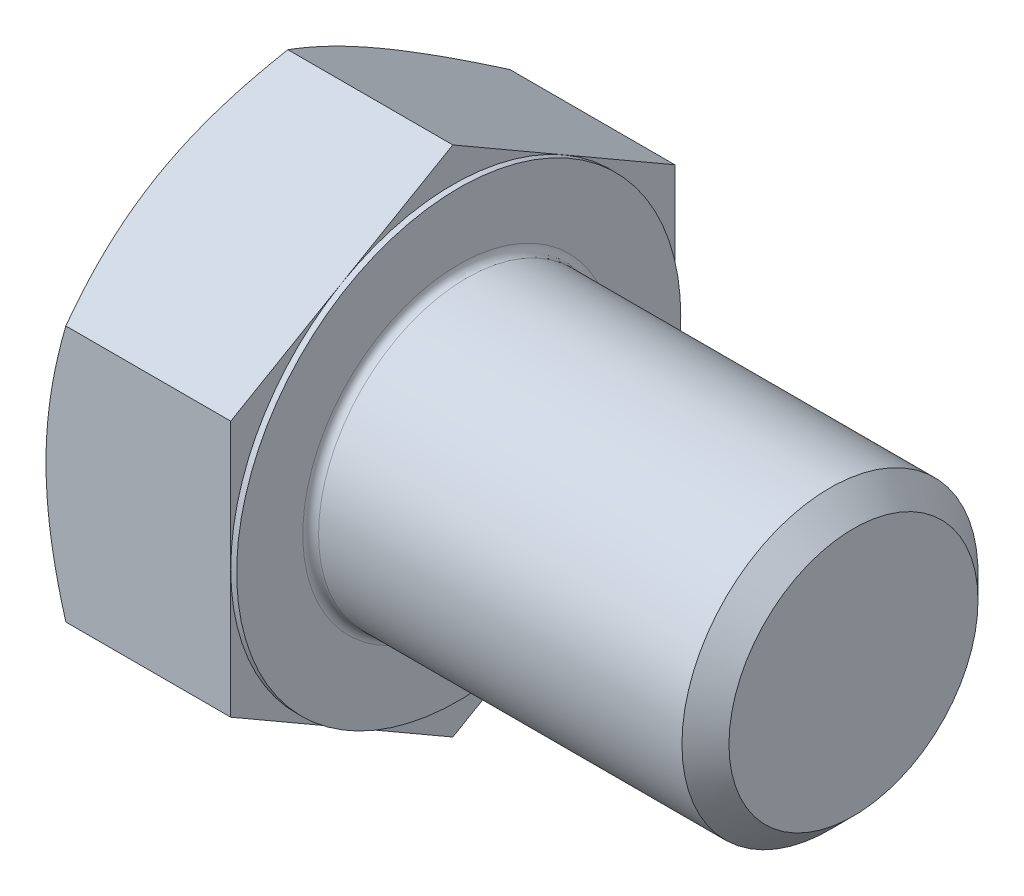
SolidWorks part; units mm, degrees
extrude "BaseHead" add sketch "Sketch1" along normal blind 12.2682
sketch "Sketch1" plane through (0, 0, 0) normal (1, 0, 0) x (0, 0, -1)
  line L0 (14.2875, 8.2489) -> (14.2875, -8.2489)
  line L1 (-14.2875, 8.2489) -> (-14.2875, -8.2489)
  line L2 (14.2875, -8.2489) -> (0, -16.4978)
  line L3 (0, -16.4978) -> (-14.2875, -8.2489)
  line L4 (14.2875, 8.2489) -> (0, 16.4978)
  line L5 (0, 16.4978) -> (-14.2875, 8.2489)
revolve "HeadChamfer" cut sketch "Sketch3" angle 360 about L6
sketch "Sketch3" plane through (0, 0, 0) normal (0, 0, 1) x (1, 0, 0)
  line L0 (0, 14.2875) -> (4.9423, 22.8478)
  line L1 (0, 16.4978) -> (0, 8.2489) construction
  line L2 (4.9423, 22.8478) -> (4.9423, 29.1978)
  line L3 (4.9423, 29.1978) -> (-12.7, 29.1978)
  line L4 (-12.7, 29.1978) -> (-12.7, 14.2875)
  line L5 (-12.7, 14.2875) -> (0, 14.2875)
  line L6 (0, 0) -> (99.06, 0) construction
  line L7 (12.2682, 16.4978) -> (0, 16.4978) construction
ref_plane "Plane1" through (0, 0, 0) normal (0, 0, 1) x (1, 0, 0)
ref_plane "Plane2" through (0, 0, 0) normal (0, 1, 0) x (1, 0, 0)
ref_plane "Plane3" through (0, 0, 0) normal (1, 0, 0) x (0, 0, -1)
sketch "BodySke" plane through (0, 0, 0) normal (0, 0, 1) x (1, 0, 0)
  line L0 (0, 8.2489) -> (0, -8.2489) construction
  line L1 (0, 0) -> (37.6682, 0)
  line L2 (0, 0) -> (0, 9.525)
  line L3 (0, 9.525) -> (36.1556, 9.525)
  line L4 (37.6682, 0) -> (37.6682, 8.0124)
  line L5 (12.2682, 16.4978) -> (12.2682, 8.2489) construction
  line L6 (37.6682, 8.0124) -> (36.1556, 9.525)
  line L7 (0, 0) -> (96.52, 0) construction
  line L8 (37.6682, -8.0124) -> (36.1556, -9.525) construction
  line L9 (0, -9.525) -> (36.1556, -9.525) construction
  line L10 (14.8082, 15.24) -> (14.8082, -1.27) construction
  line L11 (12.2682, 15.24) -> (12.2682, -1.27) construction
  line L12 (12.2682, 8.2489) -> (12.2682, -8.2489) construction
revolve "BaseBody" add sketch "BodySke" angle 360 about L7
sketch "Sketch4" plane through (0, 0, 0) normal (0, 0, 1) x (1, 0, 0)
  line L1 (12.2682, 16.4978) -> (12.2682, 8.2489) construction
  line L2 (12.2682, 14.2875) -> (11.8872, 14.2875)
  line L3 (12.2682, 14.2875) -> (12.2682, 41.8978)
  line L4 (12.2682, 41.8978) -> (11.8872, 41.8978)
  line L5 (0, 0) -> (95.25, 0) construction
  line L6 (0, 0) -> (96.52, 0) construction
  line L7 (11.8872, 14.2875) -> (11.8872, 41.8978)
  line L8 (12.2682, 16.4978) -> (1.2761, 16.4978) construction
revolve "BearingFace" cut sketch "Sketch4" angle 360 about L5
fillet "HeadFillet" radius 0.508 1 edges at (12.2682, 0, -9.525)
sketch "ThdSchSke" plane through (0, 0, 0) normal (0, 0, 1) x (1, 0, 0)
  line L0 (14.8082, -8.0124) -> (13.7491, -9.525)
  line L1 (14.8082, -8.0124) -> (15.8673, -9.525)
  line L2 (15.8673, -9.525) -> (15.8673, -11.9062)
  line L3 (-3.175, 0) -> (5.1513, 0) construction
  line L5 (15.8673, -11.9062) -> (13.7491, -11.9062)
  line L6 (13.7491, -11.9062) -> (13.7491, -9.525)
revolve "ThreadSchematic" [suppressed] cut sketch "ThdSchSke" angle 360 about L3
pattern_linear "ThdSchPat" [suppressed]
equation "\"D3@Sketch1\" = \"Width_flats@Sketch1\" / 2"
equation "\"D4@Sketch1\" = \"D3@Sketch1\""
equation "\"D5@Sketch1\" = \"D4@Sketch1\""
equation "\"Thread_minor@ThreadCosmetic\" = \"Minor_dia@BodySke\""
equation "\"D1@Sketch3\" = \"Width_flats@Sketch1\" / 2"
equation "\"D1@Sketch4\" = \"Width_flats@Sketch1\" / 2"
equation "\"Thread_length@ThreadCosmetic\" = ((sgn( (\"Length@BodySke\" - \"Advance@BodySke\" ) - \"Thread_nom@BodySke\" )-1)*( (\"Length@BodySke\" - \"Advance@BodySke\" ) - \"Thread_nom@BodySke\" ))/-2+ \"Thread_nom@BodySke\""
equation "\"Thread_minor@ThdSchSke\" = \"Minor_dia@BodySke\""
equation "\"Diameter@ThdSchSke\" = \"Diameter@BodySke\""
equation "\"Overcut@ThdSchSke\" = \"Diameter@BodySke\" * 1.25"
equation "\"Start@ThdSchSke\" = \"Head_ht@BaseHead\" + \"Length@BodySke\" - \"Thread_length@ThreadCosmetic\"  '---Non-countersunk---"
equation "\"Num_threads@ThdSchPat\" = int( \"Thread_length@ThreadCosmetic\" / \"Advance@BodySke\" + 0.999 )  + 1"
equation "\"Advance@ThdSchPat\" = \"Thread_length@ThreadCosmetic\" /  (\"Num_threads@ThdSchPat\" - 1) 'relax it"
equation "\"Num_threads@ThdSchPat\" = \"Num_threads@ThdSchPat\" - sgn( \"Num_threads@ThdSchPat\" - 1) '---chamfered tips only---"
